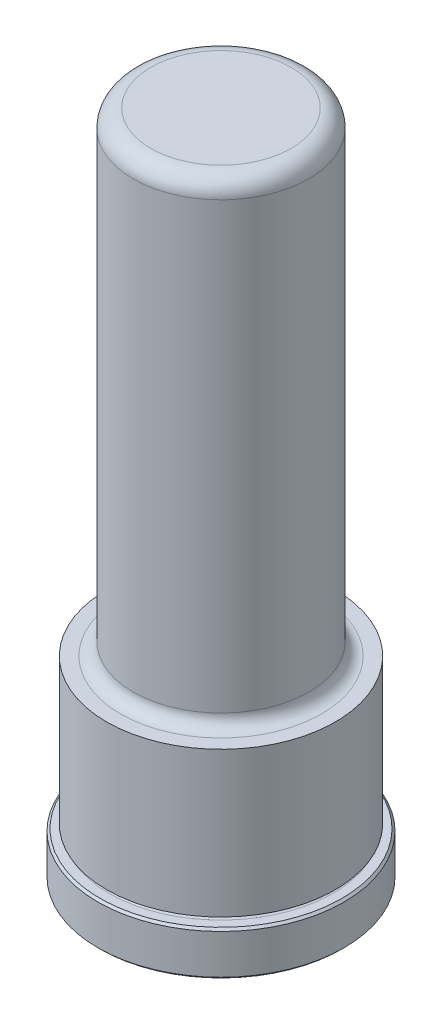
SolidWorks part; units mm, degrees
ref_plane "Front Plane" through (0, 0, 0) normal (0, 0, 1) x (1, 0, 0)
ref_plane "Top Plane" through (0, 0, 0) normal (0, 1, 0) x (1, 0, 0)
ref_plane "Right Plane" through (0, 0, 0) normal (1, 0, 0) x (0, 0, -1)
sketch "Sketch1" plane through (0, 0, 0) normal (1, 0, 0) x (0, 0, -1)
  line L0 (0, 0) -> (22.225, 0)
  line L1 (22.225, 0) -> (22.225, 7.9248)
  line L2 (22.225, 7.9248) -> (20.2438, 7.9248)
  line L3 (19.8628, 2.6782) -> (19.8628, 5.9795) construction
  line L4 (20.2438, 8.6868) -> (20.6502, 8.6868)
  line L5 (20.6502, 8.6868) -> (20.6502, 34.925)
  line L6 (20.6502, 34.925) -> (18.1483, 34.925)
  line L7 (15.8623, 37.211) -> (15.8623, 120.65)
  line L9 (15.8623, 120.65) -> (0, 120.65)
  line L10 (0, 120.65) -> (0, 0)
  line L11 (0, 0) -> (0, -7.2694) construction
  arc A0 (20.2438, 8.6868) -> (20.2438, 7.9248) centre (20.2438, 8.3058) ccw
  arc A1 (18.1483, 34.925) -> (15.8623, 37.211) centre (18.1483, 37.211) cw
  point P2 (15.8623, 120.65)
  point P14 (15.8623, 120.8223)
  point P19 (15.8623, 34.925)
  point P20 (15.8623, 120.4572)
  dimension "D14" = 0.762
  dimension "D8" = 2.286
  dimension "T" = 7.9248
  dimension "D2" = 0.762
  dimension "M" = 44.45
  dimension "B" = 41.3004
  dimension "L" = 120.65
  dimension "D7" = 0.7874
  dimension "A" = 34.925
  dimension "D" = 31.7246
  dimension "D15" = 85.725
revolve "Revolve1" add sketch "Sketch1" angle 360 about L11
chamfer "Chamfer1" distance 0.381 angle 45 2 edges at (0, 0, 22.225) (0, 7.9248, 22.225)
fillet "Fillet7" radius 3.175 1 edges at (0, 120.65, 15.8623)
